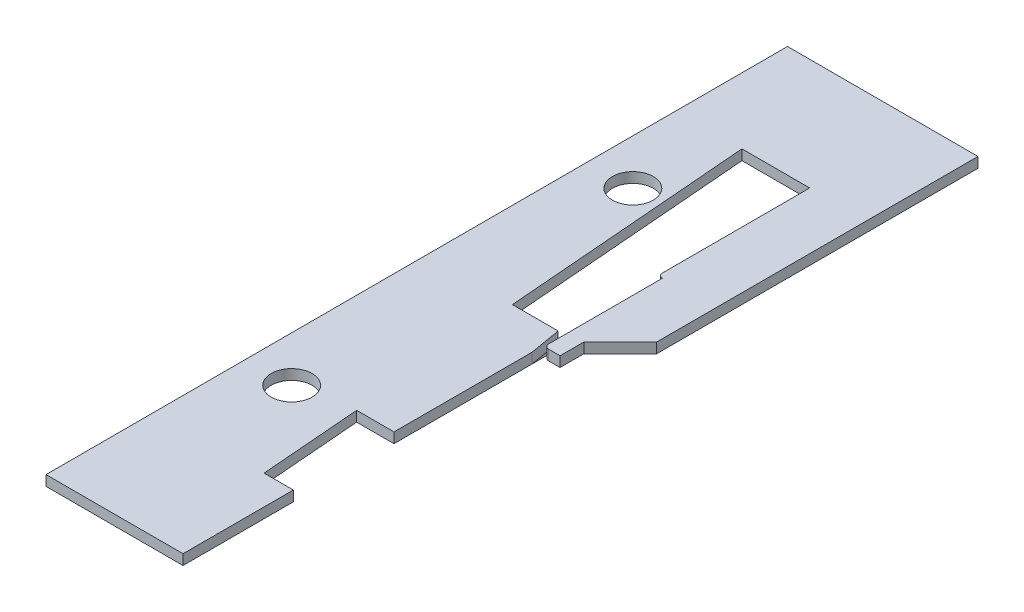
SolidWorks part; units mm, degrees
ref_plane "Front Plane" through (0, 0, 0) normal (0, 0, 1) x (1, 0, 0)
ref_plane "Top Plane" through (0, 0, 0) normal (0, 1, 0) x (1, 0, 0)
ref_plane "Right Plane" through (0, 0, 0) normal (1, 0, 0) x (0, 0, -1)
sketch "Sketch11" plane through (0, 0, 0) normal (0, 1, 0) x (1, 0, 0)
  line L0 (46.85, 4.4) -> (46.85, 32.65)
  line L1 (46.85, 4.4) -> (43.65, 1.2)
  line L3 (30.1, 32.65) -> (46.85, 32.65)
  line L4 (30.1, -32.55) -> (30.1, 32.65)
  line L5 (42.25, 8.3) -> (42.25, 9.5)
  line L6 (43.65, 1.2) -> (43.65, -0.9)
  line L7 (41.85, 9.9) -> (41.85, 22.85)
  line L8 (37.6615, 0.9) -> (41.6826, 0.9)
  line L9 (42.15, -22.85) -> (42.15, -32.55)
  line L10 (42.65, -0.9) -> (43.65, -0.9)
  line L11 (38.8629, -14) -> (39.5765, -22.85)
  line L14 (30.1, -32.55) -> (42.15, -32.55)
  line L18 (38.8629, -14) -> (42.15, -14)
  line L22 (41.6826, 0.9) -> (42.15, -1.8733)
  line L25 (42.25, 8.3) -> (42.25, -0.5)
  line L28 (42.15, -1.8733) -> (42.15, -14)
  line L32 (41.85, 22.85) -> (35.8916, 22.85)
  line L33 (35.8916, 22.85) -> (37.6615, 0.9)
  line L34 (42.15, -22.85) -> (39.5765, -22.85)
  arc A0 (41.85, 9.9) -> (42.25, 9.5) centre (42.25, 9.9) ccw
  arc A1 (42.25, -0.5) -> (42.65, -0.9) centre (42.65, -0.5) ccw
  circle A2 centre (34.1, -14.95) radius 1.8
  circle A4 centre (34.1, 15.05) radius 1.8
  point P72 (43.65, 5.2)
sketch "Sketch13" plane through (0, 0, 0) normal (0, 1, 0) x (1, 0, 0)
  line L1 (43.25, 13.5) -> (42.25, 13.5)
  line L2 (43.25, 13.5) -> (43.25, -0.5)
  line L3 (43.25, -0.5) -> (42.25, -0.5)
  line L4 (42.25, 13.5) -> (42.25, -0.5)
  line L5 (40.75, 0.5) -> (41.75, 0.5)
  line L6 (40.75, 0.5) -> (40.75, -13.5)
  line L7 (40.75, -13.5) -> (41.75, -13.5)
  line L8 (41.75, 0.5) -> (41.75, -13.5)
extrude "Boss-Extrude1" add sketch "Sketch11" along normal blind 0.9
extrude "Boss-Extrude3" add sketch "Sketch13" against normal blind 0.4
